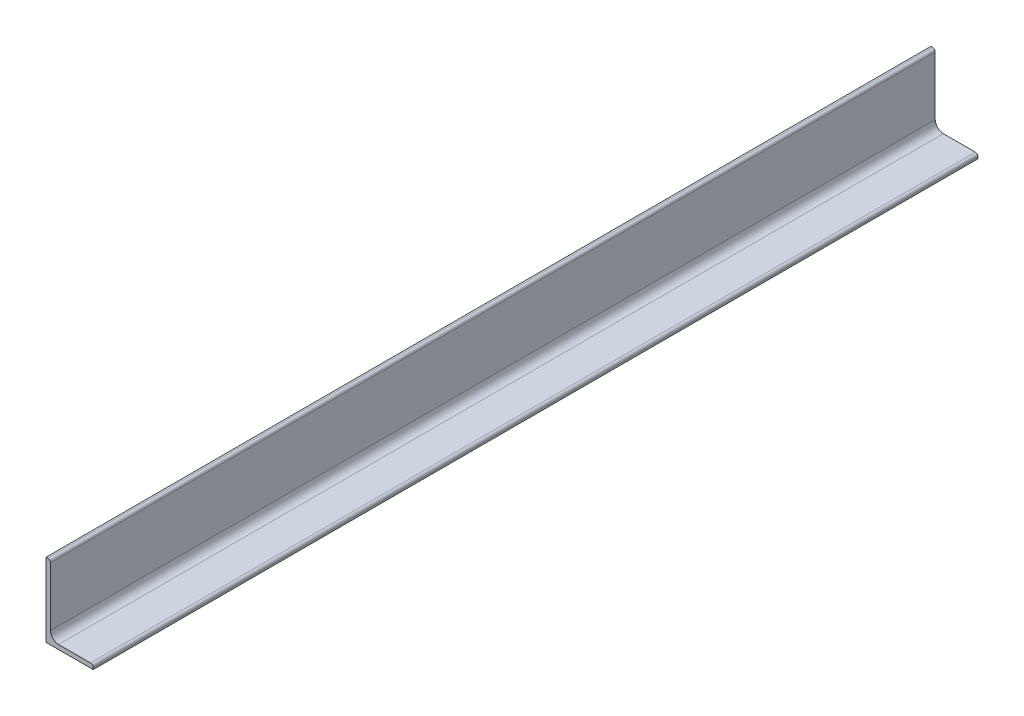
SolidWorks part; units mm, degrees
ref_plane "前视基准面" through (0, 0, 0) normal (0, 0, 1) x (1, 0, 0)
ref_plane "上视基准面" through (0, 0, 0) normal (0, 1, 0) x (1, 0, 0)
ref_plane "右视基准面" through (0, 0, 0) normal (1, 0, 0) x (0, 0, -1)
sketch "草图1" plane through (0, 0, 0) normal (0, 0, 1) x (1, 0, 0)
  line L0 (0, 0) -> (0, 50)
  line L1 (0, 50) -> (1.2, 50)
  line L2 (3, 48.2) -> (3, 8.5)
  line L3 (8.5, 3) -> (30.2, 3)
  line L4 (32, 1.2) -> (32, 0)
  line L5 (32, 0) -> (0, 0)
  arc A0 (3, 48.2) -> (1.2, 50) centre (1.2, 48.2) ccw
  arc A1 (32, 1.2) -> (30.2, 3) centre (30.2, 1.2) ccw
  arc A2 (8.5, 3) -> (3, 8.5) centre (8.5, 8.5) cw
  point P9 (3, 50)
  point P12 (32, 3)
  dimension "D5" = 1.8
  dimension "D6" = 1.8
  dimension "D7" = 5.5
  dimension "D1" = 50
  dimension "D2" = 32
  dimension "D3" = 3
  dimension "D4" = 3
extrude "拉伸1" add sketch "草图1" along normal blind 600
sketch "草图2" plane through (0, 0, 0) normal (0, 1, 0) x (1, 0, 0)
  line L0 (0, 0) -> (0, -600)
  dimension "D1" = 600
equation "\"D4@草图1\" = \"D3@草图1\""
equation "\"D6@草图1\" = \"D5@草图1\""
equation "\"D1@草图2\" = \"D1@拉伸1\""
